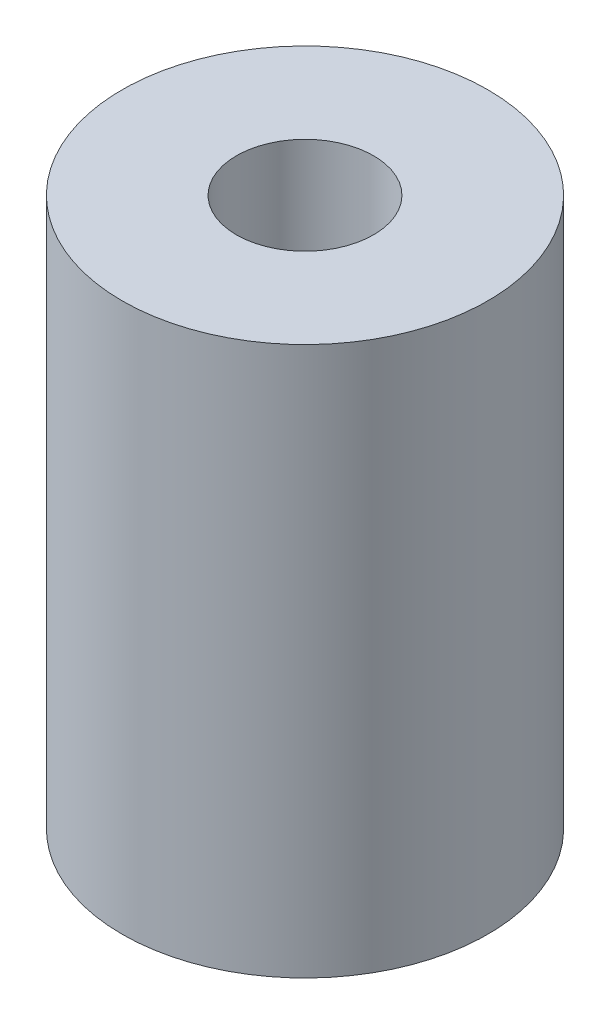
SolidWorks part; units mm, degrees
ref_plane "Front Plane" through (0, 0, 0) normal (0, 0, 1) x (1, 0, 0)
ref_plane "Top Plane" through (0, 0, 0) normal (0, 1, 0) x (1, 0, 0)
ref_plane "Right Plane" through (0, 0, 0) normal (1, 0, 0) x (0, 0, -1)
sketch "Sketch1" plane through (0, 0, 0) normal (0, 1, 0) x (1, 0, 0)
  circle A0 centre (0, 0) radius 12.7
  dimension "D1" = 25.4
extrude "Extrude1" add sketch "Sketch1" against normal blind 38.1
sketch "Sketch2" plane through (0, 0, 0) normal (0, 1, 0) x (1, 0, 0)
  circle A0 centre (0, 0) radius 3.175
  dimension "D1" = 6.35
extrude "Extrude2" [suppressed] cut sketch "Sketch2" against normal blind 17.018
sketch "Sketch3" plane through (0, -38.1, 0) normal (0, -1, 0) x (1, 0, 0)
  circle A0 centre (0, 0) radius 3.175
  dimension "D1" = 6.35
extrude "Extrude3" cut sketch "Sketch3" against normal blind 17.018
sketch "Sketch5" plane through (0, 0, 0) normal (0, 1, 0) x (-1, 0, 0)
  circle A0 centre (0, 0) radius 4.7625
  dimension "D1" = 9.525
extrude "Extrude4" cut sketch "Sketch5" against normal blind 17.018
